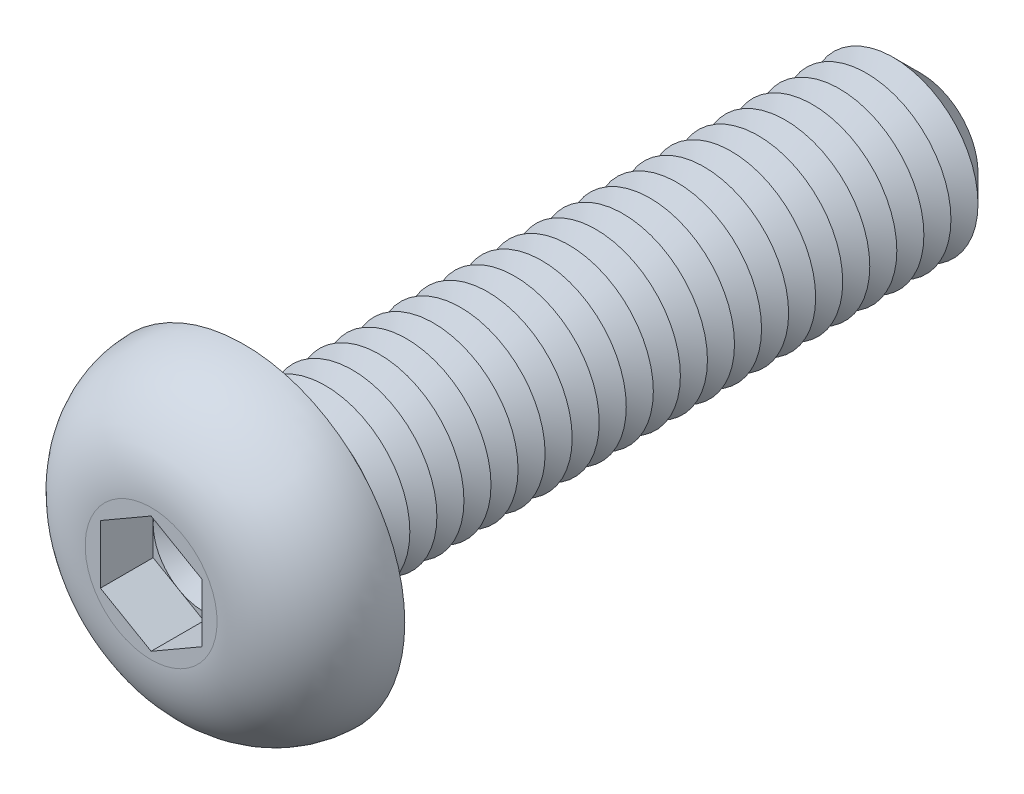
SolidWorks part; units mm, degrees
ref_plane "Front Plane" through (0, 0, 0) normal (0, 0, 1) x (1, 0, 0)
ref_plane "Top Plane" through (0, 0, 0) normal (0, 1, 0) x (1, 0, 0)
ref_plane "Right Plane" through (0, 0, 0) normal (1, 0, 0) x (0, 0, -1)
sketch "Sketch1" plane through (0, 0, 0) normal (1, 0, 0) x (0, 0, -1)
  line L0 (-47.9342, 0) -> (60.3146, 0) construction
sketch "Sketch2" plane through (0, 0, 0) normal (1, 0, 0) x (0, 0, -1)
  line L0 (0, 0) -> (-2.75, 0)
  line L1 (-47.9342, 0) -> (60.3146, 0) construction
  line L2 (-2.75, 0) -> (-2.75, 1.9504)
  line L3 (0, 4.75) -> (0, 0)
  arc A0 (-2.75, 1.9504) -> (0, 4.75) centre (0.05, 1.9504) cw
  dimension "D1" = 2.8
  dimension "D2" = 2.75
  dimension "D3" = 4.75
revolve "Revolve1" add sketch "Sketch2" angle 360 about L0
sketch "Sketch3" plane through (0, 0, 2.75) normal (0, 0, 1) x (1, 0, 0)
  line L1 (0, 1.7321) -> (-1.5, 0.866)
  line L2 (-1.5, 0.866) -> (-1.5, -0.866)
  line L3 (-1.5, -0.866) -> (0, -1.7321)
  line L4 (0, -1.7321) -> (1.5, -0.866)
  line L5 (1.5, -0.866) -> (1.5, 0.866)
  line L6 (1.5, 0.866) -> (0, 1.7321)
  circle A0 centre (0, 0) radius 1.5 construction
  dimension "D1" = 3
extrude "Cut-Extrude1" cut sketch "Sketch3" against normal blind 1.56
sketch "Sketch4" plane through (0, 0, 0) normal (0, 0, -1) x (-1, 0, 0)
  circle A0 centre (0, 0) radius 2.5
  dimension "D1" = 5
extrude "Boss-Extrude1" add sketch "Sketch4" along normal blind 20
chamfer "Chamfer1" distance 0.8 angle 45 1 edges at (-2.5, 0, -20)
sketch "Sketch5" plane through (0, 0, 0) normal (1, 0, 0) x (0, 0, -1)
  line L0 (0.8, 2.5) -> (1.6, 2.5)
  line L1 (19.2, 2.5) -> (0, 2.5) construction
  line L2 (1.6, 2.5) -> (1.2, 1.8072)
  line L3 (1.2, 1.8072) -> (0.8, 2.5)
  line L4 (0, -4.75) -> (0, 4.75) construction
  line L5 (19.2, 2.5) -> (0, 2.5) construction
  dimension "D1" = 0.8
  dimension "D2" = 0.8
revolve "Cut-Revolve1" cut sketch "Sketch5" angle 360 about L0
pattern_linear "LPattern1" count 23 spacing 0.8 along (0, 0, -1) of "Cut-Revolve1"
fillet "Fillet2" radius 0.4 1 edges at (2.5, 0, 0)
sketch "Sketch6" plane through (0, 0, 1.19) normal (0, 0, 1) x (1, 0, 0)
  line L0 (0, -1.7321) -> (1.5, -0.866) construction
  circle A0 centre (0, 0) radius 1.5
extrude "Cut-Extrude2" cut sketch "Sketch6" against normal through all draft 60
